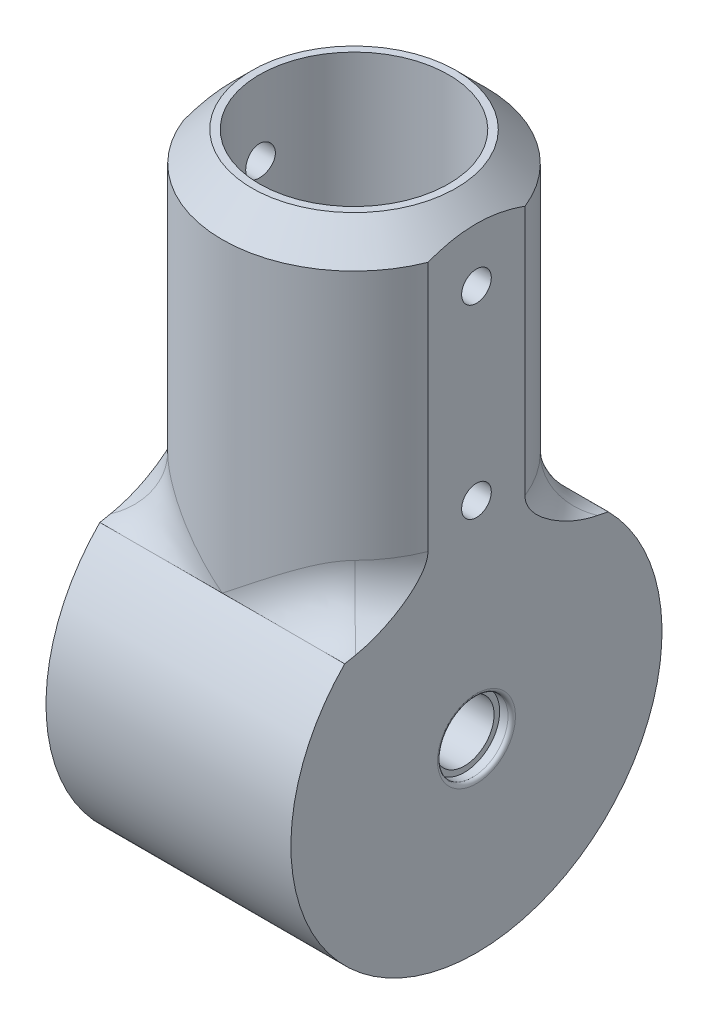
SolidWorks part; units mm, degrees
ref_plane "Front Plane" through (0, 0, 0) normal (0, 0, 1) x (1, 0, 0)
ref_plane "Top Plane" through (0, 0, 0) normal (0, 1, 0) x (1, 0, 0)
ref_plane "Right Plane" through (0, 0, 0) normal (1, 0, 0) x (0, 0, -1)
sketch "Sketch1" plane through (0, 0, 0) normal (0, 1, 0) x (1, 0, 0)
  line L0 (-16.5, 0) -> (16.5, 0) construction
  line L1 (16.5, 6.5431) -> (16.5, -6.5431)
  line L2 (-16.5, -6.5431) -> (-16.5, 6.5431)
  circle A0 centre (0, 0) radius 12.75
  arc A1 (-16.5, -6.5431) -> (16.5, -6.5431) centre (0, 0) ccw
  circle A2 centre (0, 0) radius 17.75 construction
  arc A3 (16.5, 6.5431) -> (-16.5, 6.5431) centre (0, 0) ccw
  point P8 (0, 0)
  point P11 (16.5, 0)
  point P13 (-16.5, 0)
  point P14 (0, -16.7052)
  point P15 (-11.2454, -13.7333)
  point P16 (-16.7052, 6)
  dimension "D1" = 25.5
  dimension "D3" = 33
  dimension "D2" = 5
extrude "Boss-Extrude1" add sketch "Sketch1" along normal blind 45.25
sketch "Sketch2" plane through (0, 0, 0) normal (1, 0, 0) x (0, 0, -1)
  line L0 (0, 0) -> (0, 45.25) construction
  line L3 (-6.5431, 45.25) -> (6.5431, 45.25) construction
  circle A0 centre (0, 10.2) radius 2
  circle A1 centre (0, 35.2) radius 2
  point P2 (0, 0)
  point P3 (0, 45.5373)
  point P4 (0, 0)
  point P5 (0, 45.25)
  point P10 (0, 0)
  dimension "D1" = 4
  dimension "D2" = 25
  dimension "D3" = 10.2
  dimension "D4" = 45.25
extrude "Cut-Extrude1" cut sketch "Sketch2" against normal through all both and the other way through all
chamfer "Chamfer1" distance 4 angle 45 1 edges at (0, 45.25, 17.75)
sketch "Sketch4" plane through (0, 0, 0) normal (1, 0, 0) x (0, 0, -1)
  line L1 (0, 45.25) -> (0, -17.605) construction
  line L2 (12.75, 45.25) -> (-12.75, 45.25) construction
  line L4 (-17.75, 0) -> (17.75, 0)
  line L5 (-17.75, 0) -> (-6.5431, 0) construction
  line L6 (6.5431, 0) -> (17.75, 0) construction
  line L7 (-17.75, 41.25) -> (-17.75, 0) construction
  arc A2 (-17.75, 0) -> (17.75, 0) centre (0, -17.605) ccw
  arc A3 (-17.75, 0) -> (17.75, 0) centre (0, -17.605) cw construction
  point P4 (0, -17.605)
  point P5 (0, -16.5923)
  dimension "D1" = 50
extrude "Boss-Extrude5" add sketch "Sketch4" along normal mid plane 33 contours A2 L4
fillet "Fillet6" radius 7.5 4 edges at (9.973, 0, 14.6834) (9.973, 0, -14.6834) (-9.973, 0, 14.6834) (-9.973, 0, -14.6834)
sketch "Sketch5" plane through (16.5, 0, 0) normal (1, 0, 0) x (0, 0, -1)
  circle A0 centre (0, -17.605) radius 3.995
  dimension "D1" = 7.99
extrude "Cut-Extrude2" cut sketch "Sketch5" against normal up to next
sketch "Sketch6" plane through (16.5, 0, 0) normal (1, 0, 0) x (0, 0, -1)
  circle A0 centre (0, -17.605) radius 4.75
  dimension "D1" = 9.5
extrude "Cut-Extrude3" cut sketch "Sketch6" against normal blind 1.62 contours A0
mirror "Mirror1" about plane through (0, 0, 0) normal (1, 0, 0) of "Cut-Extrude3"
fillet "Fillet7" radius 0.5 2 edges at (16.5, -17.605, -4.75) (-16.5, -17.605, -4.75)
